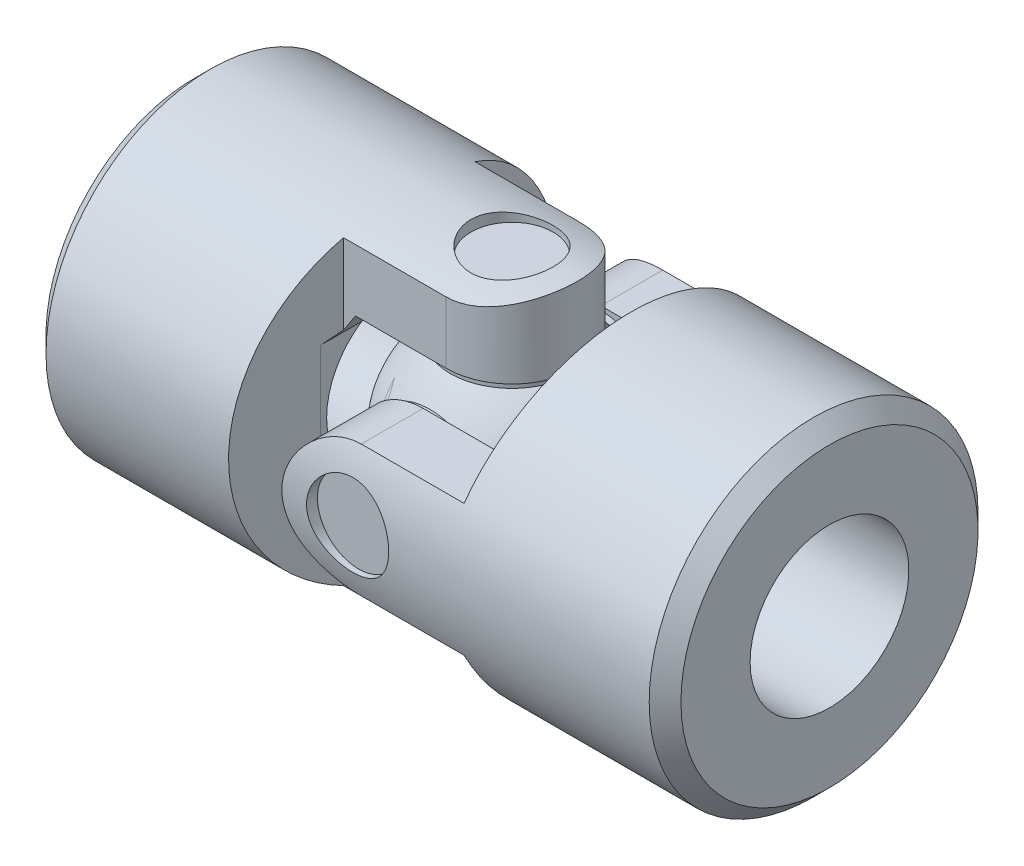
SolidWorks part; units mm, degrees
ref_plane "Ebene vorne" through (0, 0, 0) normal (0, 0, 1) x (1, 0, 0)
ref_plane "Ebene oben" through (0, 0, 0) normal (0, 1, 0) x (1, 0, 0)
ref_plane "Ebene rechts" through (0, 0, 0) normal (1, 0, 0) x (0, 0, -1)
imported_body "Importiert1"
sketch "Skizze1" plane through (0, 0, 0) normal (0, 0, 1) x (1, 0, 0)
  line L0 (22.5625, -7.25) -> (33.4375, -7.25) construction
  line L1 (22.5625, 7.25) -> (33.4375, 7.25) construction
  line L2 (22.5625, -7.25) -> (33.4375, -7.25)
  line L3 (22.5625, 7.25) -> (33.4375, 7.25)
  line L4 (0, 13.1) -> (0, -13.1) construction
  line L5 (0, 14.5) -> (56, 14.5)
  line L6 (0, 14.5) -> (0, -14.5)
  line L7 (0, -14.5) -> (56, -14.5)
  line L8 (56, 14.5) -> (56, -14.5)
  line L13 (56, -13.1) -> (56, 13.1) construction
  arc A0 (22.5625, 7.25) -> (22.5625, -7.25) centre (28, 0) ccw
  circle A1 centre (28, 0) radius 3.625 construction
  arc A2 (33.4375, -7.25) -> (33.4375, 7.25) centre (28, 0) ccw
extrude "Schnitt-Linear austragen1" cut sketch "Skizze1" against normal mid plane 46.5537
sketch "Skizze2" plane through (0, 0, 0) normal (0, 1, 0) x (1, 0, 0)
  line L0 (33.4375, -7.25) -> (22.5625, -7.25) construction
  line L1 (22.5625, 7.25) -> (33.4375, 7.25) construction
  line L2 (33.4375, -7.25) -> (22.5625, -7.25)
  line L3 (22.5625, 7.25) -> (33.4375, 7.25)
  line L5 (8.2908, 18.6706) -> (48.1117, 18.6706)
  line L6 (8.2908, 18.6706) -> (8.2908, -18.3309)
  line L7 (8.2908, -18.3309) -> (48.1117, -18.3309)
  line L8 (48.1117, 18.6706) -> (48.1117, -18.3309)
  arc A0 (22.5625, 7.25) -> (22.5625, -7.25) centre (28, 0) ccw
  circle A1 centre (28, 0) radius 5.4375 construction
  arc A2 (33.4375, -7.25) -> (33.4375, 7.25) centre (28, 0) ccw
extrude "Schnitt-Linear austragen2" cut sketch "Skizze2" against normal mid plane 212.5537
sketch "Skizze3" plane through (0, 0, 0) normal (0, 0, 1) x (1, 0, 0)
  circle A0 centre (28, 0) radius 3.625
  circle A3 centre (28, 0) radius 5.4375 construction
  dimension "D1" = 7.25
extrude "Linear austragen1" add sketch "Skizze3" along normal mid plane 27
sketch "Skizze4" plane through (0, 0, 0) normal (0, 1, 0) x (1, 0, 0)
  circle A0 centre (28, 0) radius 3.625
  circle A1 centre (28, 0) radius 5.4375 construction
  dimension "D1" = 7.25
extrude "Linear austragen2" add sketch "Skizze4" along normal mid plane 27
